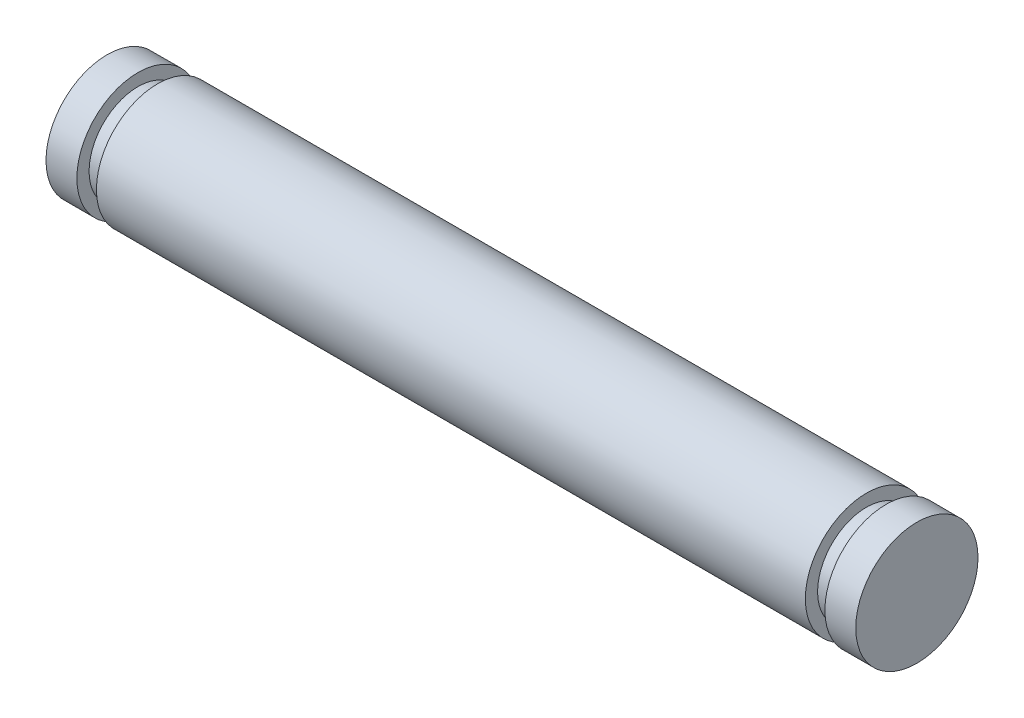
SolidWorks part; units mm, degrees
ref_plane "Front Plane" through (0, 0, 0) normal (0, 0, 1) x (1, 0, 0)
ref_plane "Top Plane" through (0, 0, 0) normal (0, 1, 0) x (1, 0, 0)
ref_plane "Right Plane" through (0, 0, 0) normal (1, 0, 0) x (0, 0, -1)
sketch "Sketch1" plane through (0, 0, 0) normal (1, 0, 0) x (0, 0, -1)
  circle A0 centre (0, 0) radius 2
  dimension "D1" = 4
extrude "Boss-Extrude1" add sketch "Sketch1" along normal mid plane 26.5
ref_axis "Axis1" through (-14.575, 0, 0) along (1, 0, 0)
sketch "Sketch2" plane through (0, 0, 0) normal (0, 1, 0) x (1, 0, 0)
  line L0 (-14.575, 0) -> (14.575, 0) construction
  line L1 (-12.24, 2) -> (-11.6, 2)
  line L2 (-12.24, 2) -> (-12.24, 1.6)
  line L3 (-12.24, 1.6) -> (-11.6, 1.6)
  line L4 (-11.6, 2) -> (-11.6, 1.6)
  line L5 (13.25, 2) -> (-13.25, 2) construction
  dimension "D1" = 0.64
  dimension "D2" = 1.6
  dimension "D3" = 11.6
revolve "Cut-Revolve1" cut sketch "Sketch2" angle 360 about axis through (-14.575, 0, 0) along (1, 0, 0)
mirror "Mirror1" about plane through (0, 0, 0) normal (1, 0, 0) of "Cut-Revolve1"
